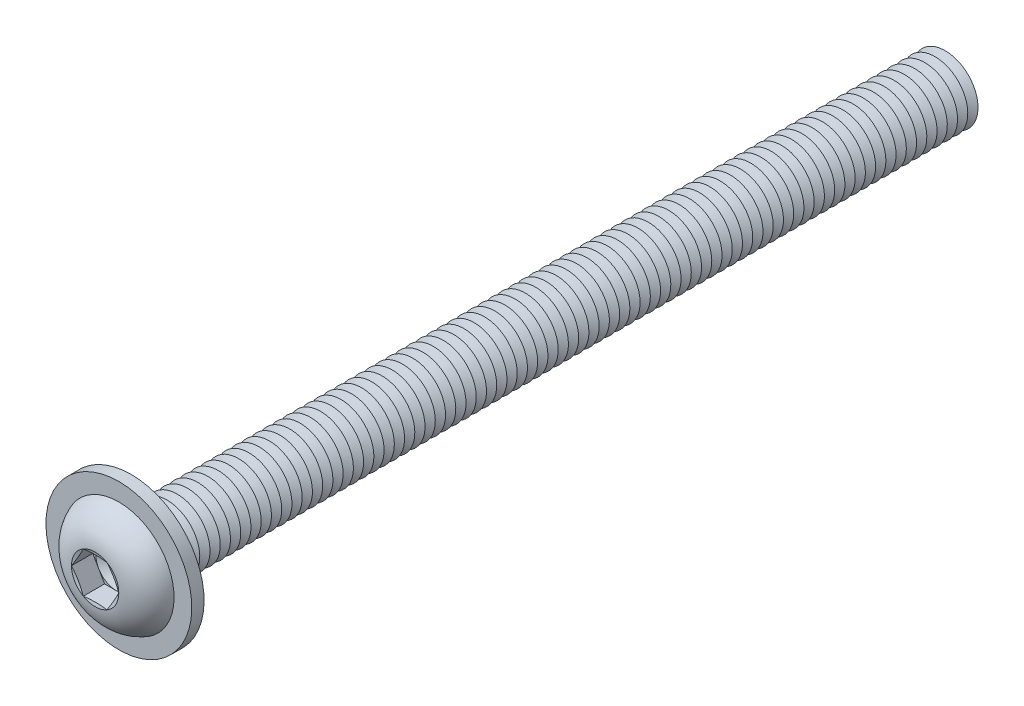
SolidWorks part; units mm, degrees
ref_plane "Front Plane" through (0, 0, 0) normal (0, 0, 1) x (1, 0, 0)
ref_plane "Top Plane" through (0, 0, 0) normal (0, 1, 0) x (1, 0, 0)
ref_plane "Right Plane" through (0, 0, 0) normal (1, 0, 0) x (0, 0, -1)
sketch "Sketch1" plane through (0, 0, 0) normal (1, 0, 0) x (0, 0, -1)
  line L0 (0, 4) -> (0, 7)
  line L3 (0, 4) -> (100, 4)
  line L4 (100, 4) -> (100, 0)
  line L5 (100, 0) -> (-4.4, 0) construction
  line L6 (-4.4, 0) -> (100, 0)
  line L7 (-4.4, 2.8867) -> (-4.4, 1.4434) construction
  line L8 (-4.4, 1.4434) -> (-4.4, 0)
  line L9 (-4.4, 2.8867) -> (-4.0132, 1.4434)
  line L10 (-4.0132, 1.4434) -> (-4.4, 1.4434)
  line L11 (100, 0) -> (22.7481, 0) construction
  line L12 (0, 7) -> (-4.4, 7) construction
  arc A1 (0, 7) -> (-4.4, 2.8867) centre (0, 2.59) ccw
  point P8 (100, 2)
  dimension "D1" = 14
  dimension "D2" = 8
  dimension "D3" = 4.4
  dimension "D4" = 5.7735
  dimension "D5" = 100
  dimension "D6" = 15
revolve "Revolve1" add sketch "Sketch1" angle 360 about L5
fillet "Fillet1" radius 0.625 1 edges at (0, 4, 0)
sketch "Sketch2" plane through (0, 0, 0) normal (1, 0, 0) x (0, 0, -1)
  line L0 (99.375, 4) -> (100.625, 4)
  line L1 (100, 4) -> (0.625, 4) construction
  line L2 (100.625, 4) -> (100, 2.9175)
  line L3 (100, -4) -> (100, 4) construction
  line L4 (100, 2.9175) -> (99.375, 4)
  dimension "D1" = 1.25
revolve "Cut-Revolve1" cut sketch "Sketch2" angle 360 about axis through (0, 0, -100) along (0, 0, -1)
pattern_linear "LPattern1" count 80 spacing 1.25 along (0, 0, 1) of "Cut-Revolve1"
sketch "Sketch3" plane through (0, 0, 4.4) normal (0, 0, 1) x (1, 0, 0)
  line L7 (1.4434, 2.5) -> (-1.4434, 2.5)
  line L8 (-1.4434, 2.5) -> (-2.8867, 0)
  line L9 (-2.8867, 0) -> (-1.4434, -2.5)
  line L10 (-1.4434, -2.5) -> (1.4434, -2.5)
  line L11 (1.4434, -2.5) -> (2.8867, 0)
  line L12 (2.8867, 0) -> (1.4434, 2.5)
  circle A0 centre (0, 0) radius 2.5 construction
  circle A3 centre (0, 0) radius 2.8867 construction
extrude "Cut-Extrude1" cut sketch "Sketch3" against normal blind 2.6
sketch "Sketch4" plane through (0, 0, 1.8) normal (0, 0, 1) x (1, 0, 0)
  line L1 (1.4434, 2.5) -> (-1.4434, 2.5) construction
  circle A0 centre (0, 0) radius 2.5
extrude "Cut-Extrude2" cut sketch "Sketch4" against normal through all draft 60
sketch "Sketch5" plane through (0, 0, 0) normal (0, 0, -1) x (-1, 0, 0)
  circle A0 centre (0, 0) radius 8.9
  circle A1 centre (0, 0) radius 4.625
  circle A2 centre (0, 0) radius 4.625 construction
  dimension "D1" = 17.8
extrude "Boss-Extrude1" add sketch "Sketch5" against normal blind 1.5
